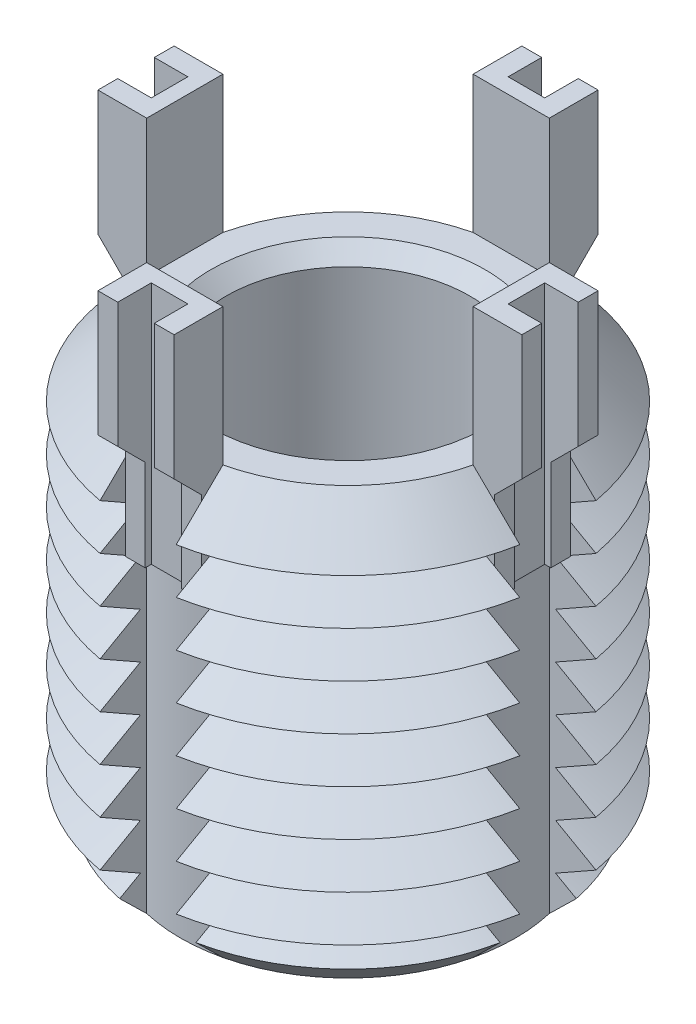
SolidWorks part; units mm, degrees
ref_plane "Front Plane" through (0, 0, 0) normal (0, 0, 1) x (1, 0, 0)
ref_plane "Top Plane" through (0, 0, 0) normal (0, 1, 0) x (1, 0, 0)
ref_plane "Right Plane" through (0, 0, 0) normal (1, 0, 0) x (0, 0, -1)
sketch "Sketch1" plane through (0, 0, 0) normal (0, 1, 0) x (1, 0, 0)
  circle A0 centre (0, 0) radius 7
  dimension "D1" = 14
extrude "Boss-Extrude1" add sketch "Sketch1" against normal blind 14
chamfer "Chamfer1" distance 1.5 angle 45 2 edges at (0, -14, 7) (0, 0, 7)
sketch "Sketch2" plane through (0, 0, 0) normal (1, 0, 0) x (0, 0, -1)
  line L0 (0, 0.8859) -> (0, -9.2617) construction
sketch "Sketch3" plane through (0, 0, 0) normal (1, 0, 0) x (0, 0, -1)
  line L0 (-7, -1.5) -> (-5.701, -2.25)
  line L1 (-5.701, -2.25) -> (-7, -3)
  line L2 (-7, -1.5) -> (-7, -12.5) construction
  line L3 (-7, -3) -> (-7, -1.5)
  dimension "D1" = 1.5
revolve "Cut-Revolve1" cut sketch "Sketch3" angle 360 about L0
pattern_linear "LPattern1" count 8 spacing 1.5 along (0, -1, 0) of "Cut-Revolve1"
sketch "Sketch4" plane through (0, 0, 0) normal (0, 1, 0) x (1, 0, 0)
  line L0 (-5.3561, 1.25) -> (-6.8875, 1.25)
  line L2 (-6.8875, -1.25) -> (-5.3561, -1.25)
  arc A0 (-5.3561, 1.25) -> (-5.3561, -1.25) centre (0, 0) ccw
  arc A1 (-6.8875, 1.25) -> (-6.8875, -1.25) centre (0, 0) ccw
  circle A2 centre (0, 0) radius 7 construction
  circle A3 centre (0, 0) radius 5.5 construction
  point P1 (-5.5, 0)
  point P3 (-7, 0)
  point P13 (0, 0)
  dimension "D1" = 2.5
extrude "Cut-Extrude1" cut sketch "Sketch4" against normal up to surface (14 mm away)
pattern_circular "CirPattern1" count 4 over 360 about axis through (0, 0, 0) along (0, 1, 0) of "Cut-Extrude1"
sketch "Sketch5" plane through (0, 0, 0) normal (1, 0, 0) x (0, 0, -1)
  line L0 (-5.3561, 4.5) -> (-5.3561, -3.5)
  line L1 (-5.3561, -3.5) -> (-6.0561, -3.5)
  line L2 (-6.0561, -3.5) -> (-6.0561, -0.5)
  line L3 (-6.0561, -0.5) -> (-6.9561, 0.4)
  line L4 (-6.9561, 0.4) -> (-6.9561, 4.5)
  line L5 (-6.9561, 4.5) -> (-5.3561, 4.5)
  line L6 (-6.8875, -4.5) -> (-1.25, -4.5) construction
  point P9 (-1.25, 0)
  point P10 (-6.0561, -0.5)
  dimension "D1" = 1
  dimension "D2" = 8
  dimension "D3" = 5
  dimension "D4" = 1.6
  dimension "D5" = 0.7
  dimension "D6" = 45
extrude "Boss-Extrude3" add sketch "Sketch5" along normal mid plane 2.5
pattern_circular "CirPattern2" count 4 over 360 about axis through (0, 0, 0) along (0, 1, 0) of "Boss-Extrude3"
sketch "Sketch6" plane through (0, 4.5, 0) normal (0, 1, 0) x (1, 0, 0)
  line L0 (-6.9561, -1.25) -> (-6.9561, 1.25) construction
  line L1 (-6.9561, -0.6) -> (-5.8561, -0.6)
  line L2 (-6.9561, -0.6) -> (-6.9561, 0.6)
  line L3 (-6.9561, 0.6) -> (-5.8561, 0.6)
  line L4 (-5.8561, -0.6) -> (-5.8561, 0.6)
  line L5 (-6.9561, -0.6) -> (-5.8561, 0.6) construction
  line L6 (-6.9561, 0.6) -> (-5.8561, -0.6) construction
  line L7 (6.9561, 1.25) -> (6.9561, -1.25) construction
  line L8 (-0.6, 5.8561) -> (0.6, 5.8561)
  line L9 (-0.6, 5.8561) -> (-0.6, 6.9561)
  line L10 (-0.6, 6.9561) -> (0.6, 6.9561)
  line L11 (0.6, 5.8561) -> (0.6, 6.9561)
  line L12 (-0.6, 5.8561) -> (0.6, 6.9561) construction
  line L13 (-0.6, 6.9561) -> (0.6, 5.8561) construction
  line L14 (5.8561, -0.6) -> (6.9561, -0.6)
  line L15 (5.8561, -0.6) -> (5.8561, 0.6)
  line L16 (5.8561, 0.6) -> (6.9561, 0.6)
  line L17 (6.9561, -0.6) -> (6.9561, 0.6)
  line L18 (5.8561, -0.6) -> (6.9561, 0.6) construction
  line L19 (5.8561, 0.6) -> (6.9561, -0.6) construction
  line L20 (-0.6, -6.9561) -> (0.6, -6.9561)
  line L21 (-0.6, -6.9561) -> (-0.6, -5.8561)
  line L22 (-0.6, -5.8561) -> (0.6, -5.8561)
  line L23 (0.6, -6.9561) -> (0.6, -5.8561)
  line L24 (-0.6, -6.9561) -> (0.6, -5.8561) construction
  line L25 (-0.6, -5.8561) -> (0.6, -6.9561) construction
  line L26 (-1.25, 6.9561) -> (1.25, 6.9561) construction
  line L27 (1.25, -6.9561) -> (-1.25, -6.9561) construction
  point P0 (-6.4061, 0)
  point P7 (-6.9561, 0)
  point P8 (-6.9561, 0)
  point P9 (0, 6.4061)
  point P14 (6.4061, 0)
  point P19 (0, -6.4061)
  point P24 (0, 6.9561)
  point P25 (6.9561, 0)
  point P26 (6.9561, 0)
  point P27 (0, 6.9561)
  point P30 (0, -6.9561)
  point P33 (0, -6.9561)
  dimension "D1" = 1.2
  dimension "D2" = 1.1
extrude "Cut-Extrude3" cut sketch "Sketch6" against normal through all both and the other way through all
sketch "Sketch7" plane through (0, 0, 0) normal (0, 1, 0) x (1, 0, 0)
  circle A0 centre (0, 0) radius 4
  dimension "D1" = 8
extrude "Cut-Extrude4" cut sketch "Sketch7" against normal up to surface (14 mm away)
chamfer "Chamfer2" distance 0.5 angle 45 2 edges at (0, 0, 4) (0, -14, 4)
